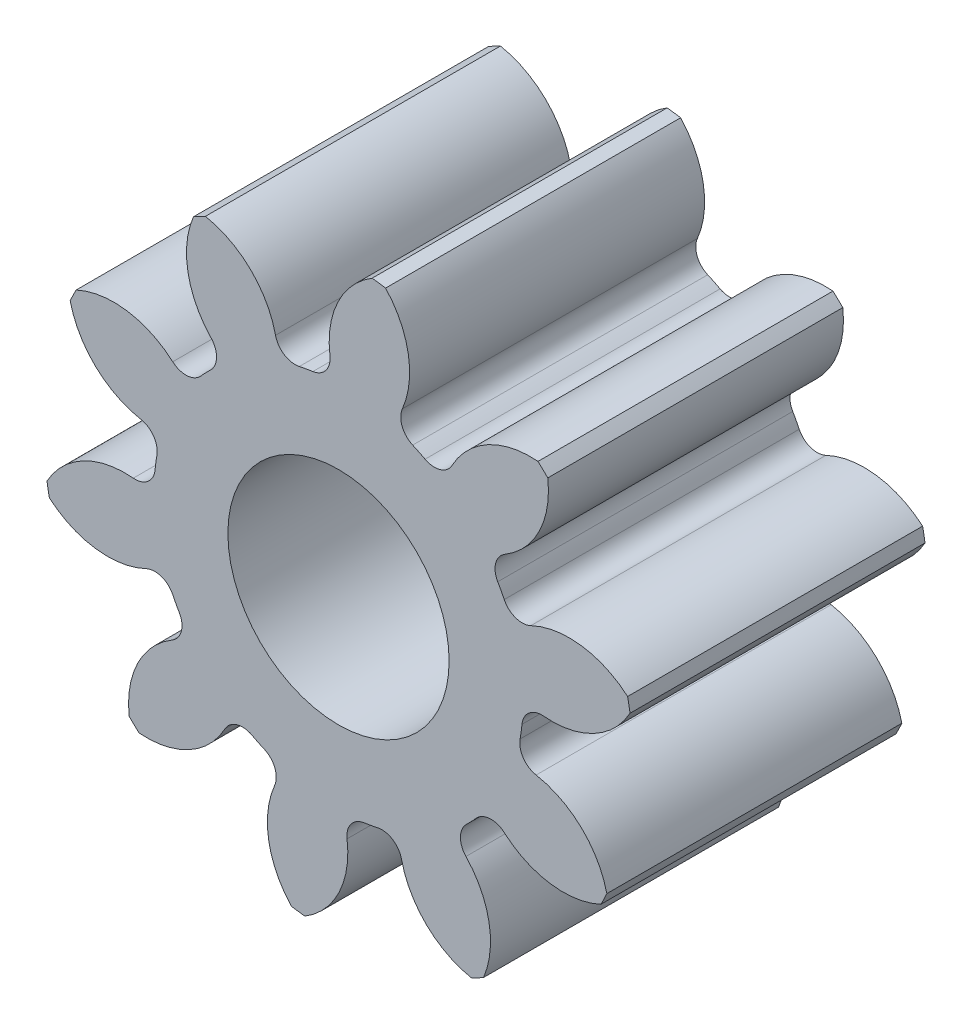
SolidWorks part; units mm, degrees
ref_plane "Front" through (0, 0, 0) normal (0, 0, 1) x (1, 0, 0)
ref_plane "Top" through (0, 0, 0) normal (0, 1, 0) x (1, 0, 0)
ref_plane "Right" through (0, 0, 0) normal (1, 0, 0) x (0, 0, -1)
sketch "Sketch3" plane through (0, 0, 0) normal (0, 0, 1) x (1, 0, 0)
  circle A0 centre (0, 0) radius 101.6
  dimension "od" = 203.2
extrude "gearBody" add sketch "Sketch3" along normal blind 101.6
sketch "Sketch2" plane through (0, 0, 0) normal (0, 0, 1) x (1, 0, 0)
  line L0 (0, 0) -> (73.5044, 30.4465) construction
  line L1 (92.9157, -44.8601) -> (0, 0) construction
  line L2 (0, 0) -> (36.3143, 0) construction
  line L3 (84.6475, 1.7994) -> (80.9867, -24.6902) construction
  line L5 (82.8171, -11.4454) -> (0, 0) construction
  line L7 (0, 0) -> (79.5606, 0) construction
  arc A0 (79.56, 0.3109) -> (76.4936, -21.8776) centre (0, 0) ccw construction
  arc A1 (100.4005, 15.566) -> (92.4153, -42.2133) centre (0, 0) ccw construction
  arc A2 (84.6475, 1.7994) -> (80.9867, -24.6902) centre (0, 0) ccw construction
  arc A3 (62.5333, -11.0382) -> (63.1831, -6.336) centre (0, 0) ccw
  arc A4 (92.9157, -44.8601) -> (68.0695, -19.0136) centre (62.4915, -49.2413) ccw
  arc A5 (92.9157, -44.8601) -> (101.6, 17.9779) centre (0, 0) ccw
  arc A6 (101.6, 17.9779) -> (70.675, -0.161) centre (73.5044, 30.4465) cw
  arc A7 (63.1831, -6.336) -> (70.675, -0.161) centre (70.0406, -7.0236) cw
  arc A8 (68.0695, -19.0136) -> (62.5333, -11.0382) centre (69.3202, -12.2362) cw
  point P6 (101.6, 17.9779)
  point P22 (92.9157, -44.8601)
  dimension "baseDia" = 159.1213
  dimension "od" = 203.2
  dimension "pd" = 169.3333
  dimension "rd" = 127
  dimension "rFillet" = 6.8919
  dimension "pointX" = 101.6
  dimension "pointY" = 17.9779
  dimension "CTT" = 26.4896
  dimension "flankCenterAngle" = 22.5
extrude "toothCut" cut sketch "Sketch2" along normal through all
pattern_circular "CirPattern1" count 10 over 360 about axis through (0, 0, 0) along (0, 0, 1) of "toothCut"
sketch "hub1Dia" plane through (0, 0, 0) normal (0, 0, -1) x (-1, 0, 0)
  circle A0 centre (0, 0) radius 12.7
  dimension "hub1Dia" = 25.4
sketch "hub2Dia" plane through (0, 0, 101.6) normal (0, 0, 1) x (1, 0, 0)
  circle A0 centre (0, 0) radius 12.7
  dimension "hub2dia" = 25.4
sketch "boreDia" plane through (0, 0, 0) normal (0, 0, 1) x (1, 0, 0)
  circle A0 centre (0, 0) radius 38.1
  dimension "boreDia" = 76.2
extrude "bore" cut sketch "boreDia" against normal mid plane 25400
